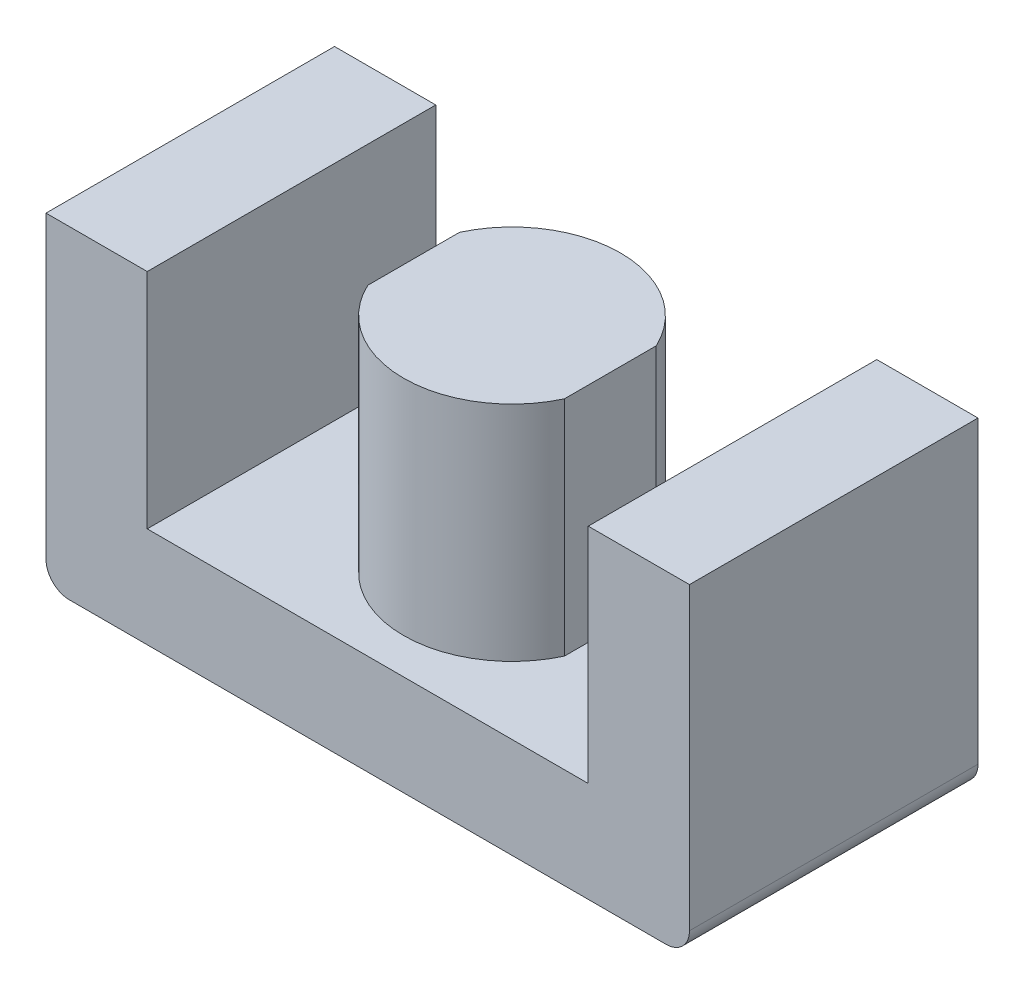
SolidWorks part; units mm, degrees
ref_plane "Front Plane" through (0, 0, 0) normal (0, 0, 1) x (1, 0, 0)
ref_plane "Top Plane" through (0, 0, 0) normal (0, 1, 0) x (1, 0, 0)
ref_plane "Right Plane" through (0, 0, 0) normal (1, 0, 0) x (0, 0, -1)
sketch "Sketch1" plane through (0, 0, 0) normal (0, 1, 0) x (1, 0, 0)
  line L1 (-27.43, 12.3) -> (27.43, 12.3)
  line L2 (-27.43, 12.3) -> (-27.43, -12.3)
  line L3 (-27.43, -12.3) -> (27.43, -12.3)
  line L4 (27.43, 12.3) -> (27.43, -12.3)
  line L5 (-27.43, 12.3) -> (27.43, -12.3) construction
  line L6 (-27.43, -12.3) -> (27.43, 12.3) construction
  point P0 (0, 0)
  dimension "D1" = 54.86
  dimension "D2" = 24.6
extrude "Boss-Extrude1" add sketch "Sketch1" along normal blind 27.56
sketch "Sketch2" plane through (0, 0, 12.3) normal (0, 0, 1) x (1, 0, 0)
  line L0 (-27.43, 27.56) -> (27.43, 27.56) construction
  line L1 (-18.8, 27.56) -> (18.8, 27.56)
  line L2 (-18.8, 27.56) -> (-18.8, 8.56)
  line L3 (-18.8, 8.56) -> (18.8, 8.56)
  line L4 (18.8, 27.56) -> (18.8, 8.56)
  line L5 (0, 8.56) -> (0, -2.2993) construction
  dimension "D1" = 37.6
  dimension "D2" = 19
extrude "Cut-Extrude1" cut sketch "Sketch2" against normal through all
sketch "Sketch3" plane through (0, 8.56, 0) normal (0, 1, 0) x (1, 0, 0)
  circle A0 centre (0, 0) radius 9.25
  dimension "D1" = 18.5
extrude "Boss-Extrude2" add sketch "Sketch3" along normal blind 19
fillet "Fillet1" radius 2 2 edges at (27.43, 0, 0) (-27.43, 0, 0)
sketch "Sketch4" plane through (0, 27.56, 0) normal (0, 1, 0) x (1, 0, 0)
  line L0 (0, 15) -> (0, -15) construction
  line L1 (-8.382, 15) -> (-8.382, -15)
  line L2 (8.382, 15) -> (8.382, -15)
  line L3 (-8.382, 15) -> (-13.382, 15)
  line L4 (-8.382, -15) -> (-13.382, -15)
  line L5 (-13.382, 15) -> (-13.382, -15)
  line L6 (13.382, 15) -> (13.382, -15)
  line L7 (8.382, 15) -> (13.382, 15)
  line L8 (8.382, -15) -> (13.382, -15)
  point P4 (0, 0)
  dimension "D3" = 30
  dimension "D4" = 5
  dimension "D1" = 8.382
  dimension "D2" = 8.382
  dimension "D5" = 5
extrude "Cut-Extrude3" cut sketch "Sketch4" against normal blind 19
